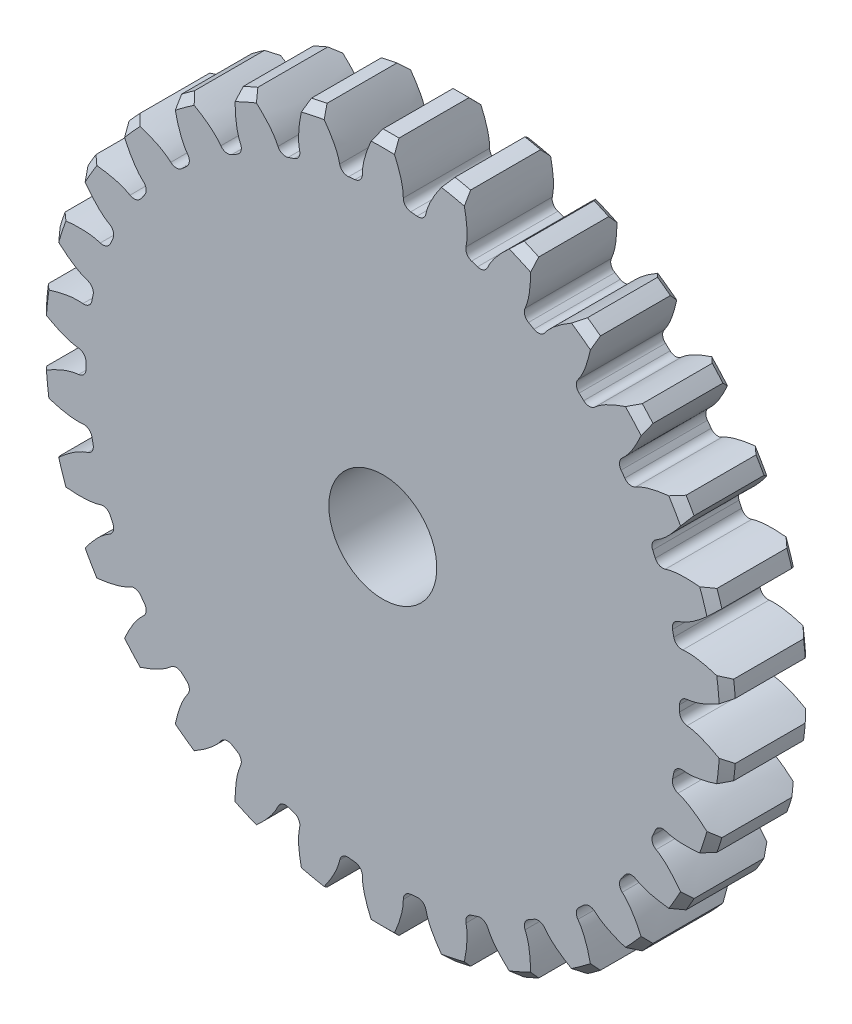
SolidWorks part; units mm, degrees
ref_plane "Plan1" through (0, 0, 0) normal (0, 0, 1) x (1, 0, 0)
ref_plane "Plan2" through (0, 0, 0) normal (0, 1, 0) x (1, 0, 0)
ref_plane "Plan3" through (0, 0, 0) normal (1, 0, 0) x (0, 0, -1)
sketch "Dent" plane through (0, 0, 0) normal (0, 0, 1) x (1, 0, 0)
  line L1 (-0.1845, 6.0656) -> (0, 5.5586)
  line L3 (0, 8) -> (0, -8) construction
  line L4 (0, 0) -> (0.1845, 7.9979) construction
  line L5 (0.3927, 7.4897) -> (-0.3927, 7.4897) construction
  line L6 (0.4739, 7.0317) -> (-0.4739, 7.0317) construction
  line L7 (-0.25, 0) -> (0.25, 0) construction
  line L9 (0.1845, 6.0656) -> (0, 5.5586)
  line L11 (0, 0) -> (0.3927, 7.4897) construction
  line L12 (0, 0) -> (0.4739, 7.0317) construction
  circle A0 centre (0, 0) radius 7.5 construction
  circle A1 centre (0, 0) radius 8 construction
  arc A2 (0.1845, 7.9979) -> (-0.1845, 7.9979) centre (0, 0) ccw
  circle A3 centre (0, 0) radius 7.0477 construction
  point P2 (-0.3927, 7.4897)
  point P3 (-0.4739, 7.0317)
  point P19 (0.3927, 7.4897)
  point P20 (0.4739, 7.0317)
sketch "Esquisse2" plane through (0, 0, 0) normal (0, 0, 1) x (1, 0, 0)
  circle A0 centre (0, 0) radius 6.875
extrude "Base-Extrusion" add sketch "Esquisse2" against normal blind 2
extrude "Boss.-Extru.1" add sketch "Dent" against normal blind 2
fillet "Congé1" radius 0.19 4 edges at (0.4582, 6.8597, -1) (-0.4588, 6.8597, -1)
chamfer "Chanfrein1" distance 0.19 angle 45 4 edges at (0, 8, -2) (0, 8, 0)
pattern_circular "Répétition circulaire1" count 30 over 360 of "Congé1", "Boss.-Extru.1", "Chanfrein1"
sketch "Esquisse3" plane through (0, 0, -2) normal (0, 0, -1) x (-1, 0, 0)
  circle A0 centre (0, 0) radius 3
  dimension "D1" = 6
extrude "Extrusion1" add sketch "Esquisse3" along normal blind 2
sketch "Esquisse4" plane through (0, 0, -4) normal (0, 0, -1) x (-1, 0, 0)
  circle A0 centre (0, 0) radius 1.25
  dimension "D1" = 2.5
extrude "Enlèv. mat.-Extru.1" cut sketch "Esquisse4" against normal through all
equation "\"Dp@Dent\" = \"Module@Dent\"*\"Nbr de dents@Répétition circulaire1\" "
equation "\"Dt@Dent\" = \"Module@Dent\"*(\"Nbr de dents@Répétition circulaire1\"+2)"
equation "\"Dpied@Esquisse2\" = \"Dp@Dent\"-(2.5*\"Module@Dent\")"
equation "\"Db@Dent\" = \"Dp@Dent\"*cos(\"Angle de pression@Dent\"*pi/180)"
equation "\"Ep au primitif@Dent\" =  (pi*\"Dp@Dent\"/2)/\"Nbr de dents@Répétition circulaire1\""
equation "\"D3@Dent\"=atn((Sin((sqr(((\"Dt@Dent\"/\"Db@Dent\")^2)-1))) -((sqr(((\"Dt@Dent\"/\"Db@Dent\")^2)-1)) * Cos((sqr(((\"Dt@Dent\"/\"Db@Dent\")^2)-1)))))/(Cos((sqr(((\"Dt@Dent\"/\"Db@Dent\")^2)-1))) +((sqr(((\"Dt@Dent\"/\"Db@"
equation "\"D4@Dent\"=atn((Sin((sqr(((\"Dp@Dent\"/\"Db@Dent\")^2)-1))) -((sqr(((\"Dp@Dent\"/\"Db@Dent\")^2)-1)) * Cos((sqr(((\"Dp@Dent\"/\"Db@Dent\")^2)-1)))))/(Cos((sqr(((\"Dp@Dent\"/\"Db@Dent\")^2)-1))) +((sqr(((\"Dp@Dent\"/\"Db@"
equation "\"D1@Congé1\" = \"Module@Dent\"*0.38"
equation "\"D1@Chanfrein1\" = \"Module@Dent\"*0.38"
